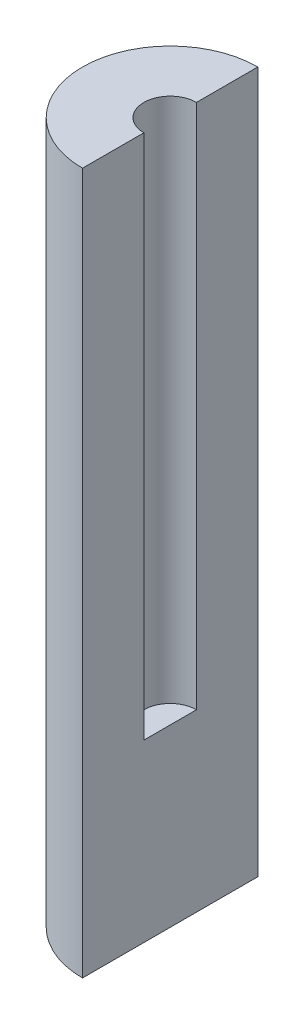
SolidWorks part; units mm, degrees
ref_plane "Front" through (0, 0, 0) normal (0, 0, 1) x (1, 0, 0)
ref_plane "Top" through (0, 0, 0) normal (0, 1, 0) x (1, 0, 0)
ref_plane "Right" through (0, 0, 0) normal (1, 0, 0) x (0, 0, -1)
sketch "Sketch1" plane through (0, 0, 0) normal (0, 1, 0) x (1, 0, 0)
  circle A0 centre (0, 0) radius 25
  dimension "D1" = 50
extrude "Extrude1" add sketch "Sketch1" along normal blind 200
sketch "Sketch2" plane through (0, 200, 0) normal (0, 1, 0) x (-1, 0, 0)
  circle A0 centre (0, 0) radius 7.5
  dimension "D1" = 15
extrude "Cut-Extrude1" cut sketch "Sketch2" against normal blind 150
sketch "Sketch3" plane through (0, 200, 0) normal (0, 1, 0) x (-1, 0, 0)
  line L1 (0, -25) -> (-25, -25)
  line L2 (0, -25) -> (0, 25)
  line L3 (0, 25) -> (-25, 25)
  line L4 (-25, -25) -> (-25, 25)
  circle A0 centre (0, 0) radius 25 construction
extrude "Cut-Extrude2" cut sketch "Sketch3" against normal through all
